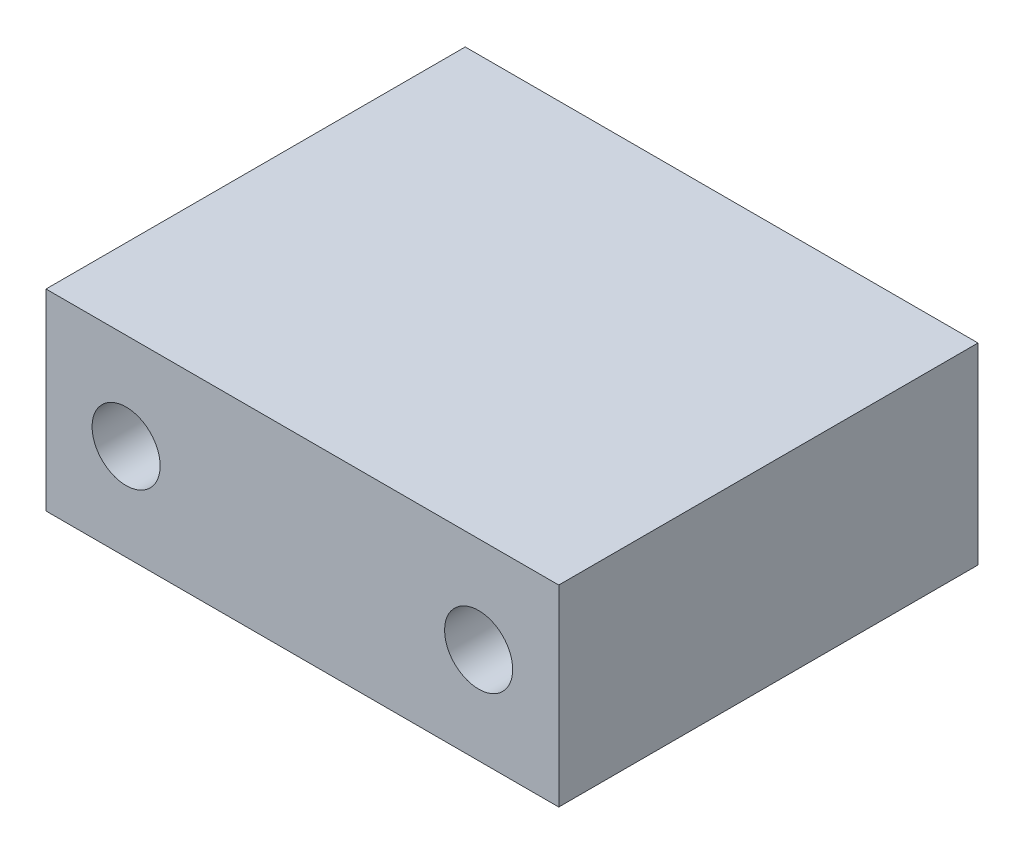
SolidWorks part; units mm, degrees
ref_plane "Front" through (0, 0, 0) normal (0, 0, 1) x (1, 0, 0)
ref_plane "Top" through (0, 0, 0) normal (0, 1, 0) x (1, 0, 0)
ref_plane "Right" through (0, 0, 0) normal (1, 0, 0) x (0, 0, -1)
sketch "Sketch1" plane through (0, 0, 84.6582) normal (0, 0, 1) x (1, 0, 0)
  line L4 (-787.4, -222.25) -> (-889, -222.25)
  line L5 (-787.4, -260.35) -> (-787.4, -222.25)
  line L6 (-889, -260.35) -> (-787.4, -260.35)
  line L7 (-889, -222.25) -> (-889, -260.35)
  line L8 (-787.4, -222.25) -> (-889, -222.25)
  line L9 (-787.4, -260.35) -> (-787.4, -222.25)
  line L10 (-889, -260.35) -> (-787.4, -260.35)
  line L11 (-889, -222.25) -> (-889, -260.35)
  dimension "D1" = 0
extrude "Boss-Extrude1" add sketch "Sketch1" against normal up to surface (84.6582 mm away) separate body
hole_wizard "CBORE for 1/2 Socket Head Cap Screw1" positions "Sketch2" profile "Sketch3" counterbore size "1/2" standard "ANSI Inch"
sketch "Sketch2" plane through (0, 0, 0) normal (0, 0, -1) x (-1, 0, 0)
  line L0 (838.2, -260.35) -> (838.2, -222.25) construction
  line L1 (787.4, -260.35) -> (889, -260.35) construction
  line L2 (889, -222.25) -> (787.4, -222.25) construction
  line L3 (838.2, -241.3) -> (873.125, -241.3) construction
  line L4 (889, -260.35) -> (889, -222.25) construction
  point P10 (873.125, -241.3)
  point P12 (803.275, -241.3)
  dimension "D1" = 15.875
sketch "Sketch3" plane through (-803.275, -241.3, 0) normal (1, 0, 0) x (0, 1, 0)
  line L0 (0, 0) -> (0, 84.6582)
  line L1 (0, 84.6582) -> (6.7462, 84.6582)
  line L3 (6.7462, 84.6582) -> (6.7462, 13.97)
  line L4 (6.7462, 13.97) -> (10.3187, 13.97)
  line L5 (10.3187, 13.97) -> (10.3187, 0)
  line L7 (10.3187, 0) -> (0, 0)
  line L11 (0, -6.35) -> (0, 107.95) construction
  dimension "Thru Hole Dia." = 13.4925
  dimension "Thru Hole Depth" = 84.6582
  dimension "C'Bore Dia." = 20.6375
  dimension "C'Bore Depth" = 13.97
chamfer "Chamfer1" distance 1.5875 angle 45 4 edges at (-838.2, -260.35, 0) (-787.4, -241.3, 0) (-838.2, -222.25, 0) (-889, -241.3, 0)
